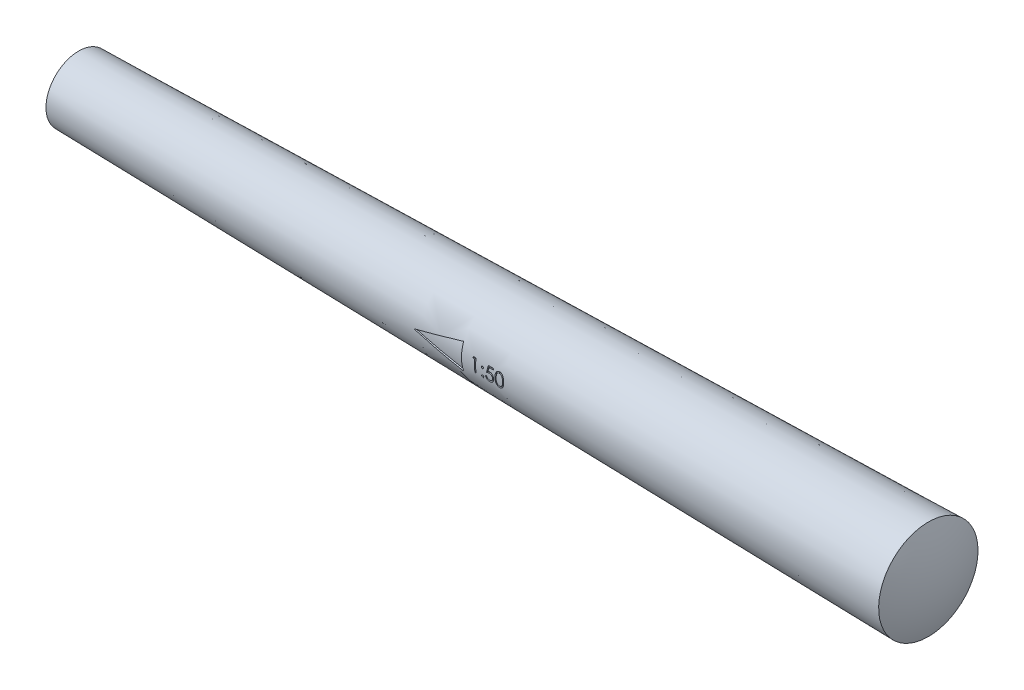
SolidWorks part; units mm, degrees
ref_plane "Front Plane" through (0, 0, 0) normal (0, 0, 1) x (1, 0, 0)
ref_plane "Top Plane" through (0, 0, 0) normal (0, 1, 0) x (1, 0, 0)
ref_plane "Right Plane" through (0, 0, 0) normal (1, 0, 0) x (0, 0, -1)
sketch "Sketch1" plane through (0, 0, 0) normal (1, 0, 0) x (0, 0, -1)
  circle A0 centre (0, 0) radius 2.5
  dimension "D1" = 5
extrude "Extrude1" add sketch "Sketch1" along normal mid plane 65
draft "Draft1" type of draft neutral plane draft angle 1.146 faces to draft 1 parameters "D1"=1.146
sketch "Sketch2" plane through (0, 0, 0) normal (0, 0, 1) x (1, 0, 0)
  line L0 (-32.5, 0) -> (-32.5, 2.5)
  line L1 (-32.5, 2.5) -> (-32.5, -2.5) construction
  line L2 (-32.5, 0) -> (-33.25, 0)
  line L3 (-33.25, 0) -> (-33.25, -3.15) construction
  line L4 (32.5, 0) -> (32.5, 3.8)
  line L5 (32.5, -3.8) -> (32.5, 3.8) construction
  line L6 (32.5, 0) -> (33.25, 0)
  line L7 (33.25, 0) -> (33.25, -3.15) construction
  line L8 (-32.5, -2.5) -> (32.5, -3.8) construction
  arc A0 (-33.25, 0) -> (-32.5, 2.5) centre (-28.7083, 0) cw
  arc A1 (33.25, 0) -> (32.5, 3.8) centre (23.2481, 0) ccw
  point P14 (0, -3.15)
revolve "Revolve1" add sketch "Sketch2" angle 360 about L2
sketch "Sketch5" plane through (0, 0, 0) normal (0, 0, 1) x (1, 0, 0)
  line L0 (0, 3.15) -> (0, -3.15) construction
  line L1 (32.5, 3.8) -> (-32.5, 2.5) construction
  line L2 (-32.5, -2.5) -> (32.5, -3.8) construction
ref_plane "Plane2" through (0, 0, 0) normal (-0.02, 0, 0.9998) x (0.9998, 0, 0.02)
sketch "Sketch6" plane through (0, 0, 0) normal (-0.02, 0, 0.9998) x (0.9998, 0, 0.02)
  line L0 (0, 0) -> (0, 1)
  line L1 (0, 3.15) -> (0, -3.15) construction
  line L2 (0, 1) -> (-3.7321, 0)
  line L3 (-3.7321, 0) -> (0, -1)
  line L4 (0, -1) -> (0, 0)
  line L5 (0, -0.5) -> (4, -0.5) construction
  text T0 "1:50" font "Century Gothic" height 1
  dimension "D1" = 2
  dimension "D2" = 30
  dimension "D3" = 4
wrap "Wrap2" sketch "Sketch6" wrap type deboss source sketch "Sketch6" thickness 0.1 parameters "D1"=0.1
equation "\"D2@Sketch2\" = \"D1@Sketch2\""
